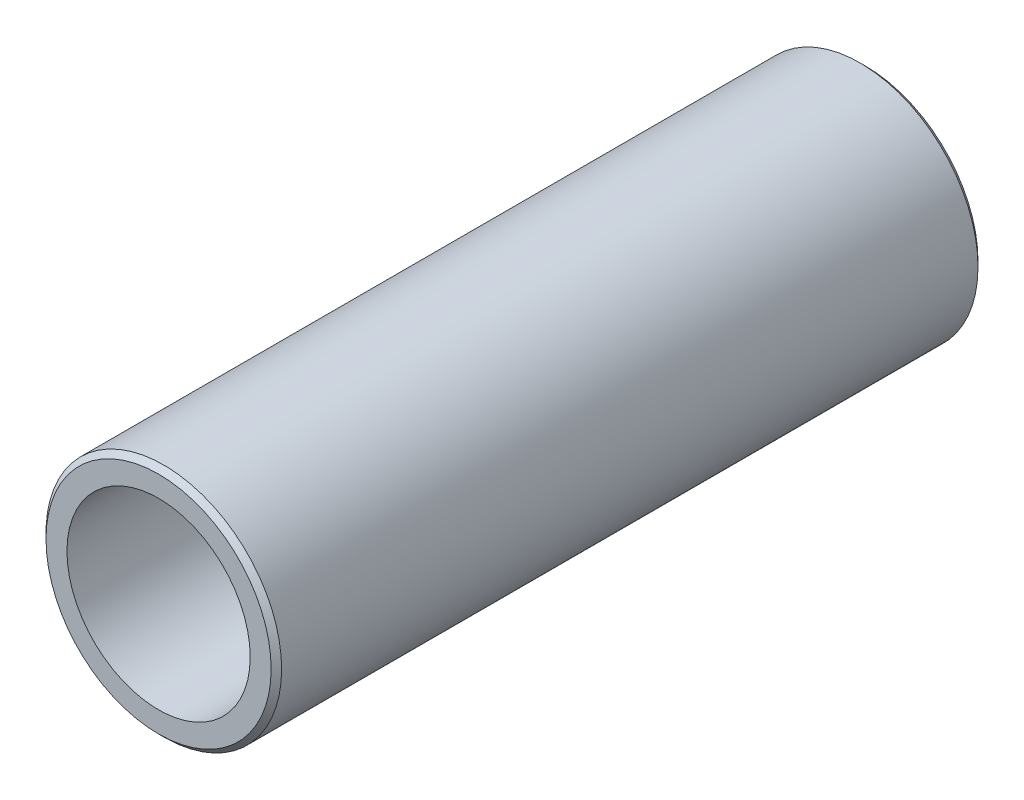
SolidWorks part; units mm, degrees
ref_plane "Plan de face" through (0, 0, 0) normal (0, 0, 1) x (1, 0, 0)
ref_plane "Plan de dessus" through (0, 0, 0) normal (0, 1, 0) x (1, 0, 0)
ref_plane "Plan de droite" through (0, 0, 0) normal (1, 0, 0) x (0, 0, -1)
sketch "Esquisse1" plane through (0, 0, 0) normal (0, 0, 1) x (1, 0, 0)
  circle A0 centre (-20.5, 0) radius 4.5
  circle A1 centre (-20.5, 0) radius 3.5
  dimension "D1" = 1
extrude "Boss.-Extru.1" add sketch "Esquisse1" against normal blind 27
chamfer "Chanfrein1" distance 0.2 angle 45 2 edges at (-16, 0, 0) (-16, 0, -27)
